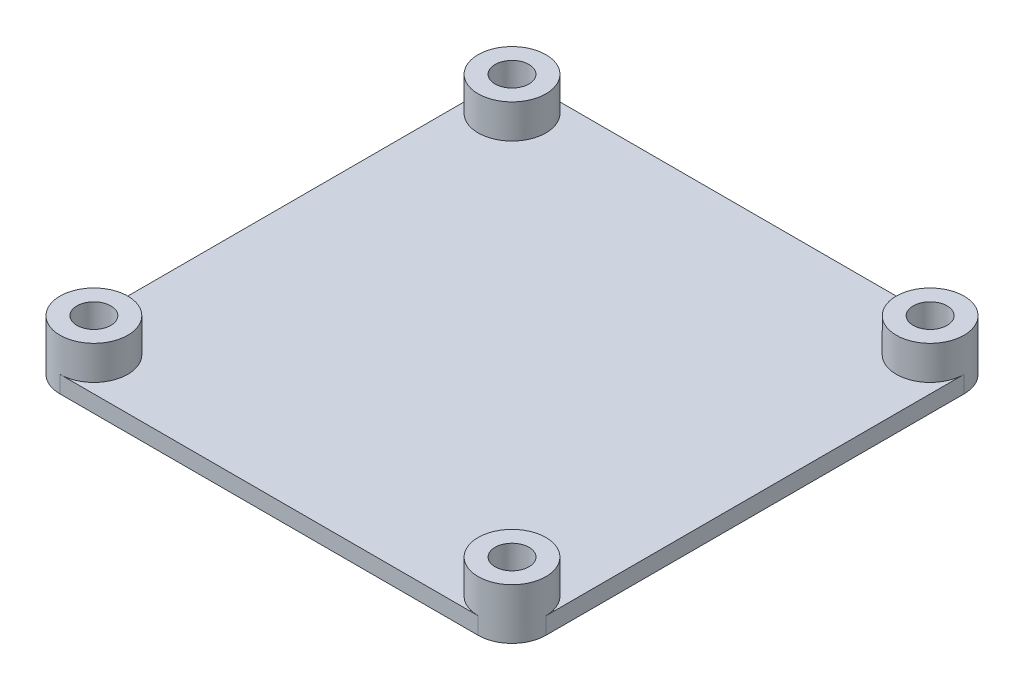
SolidWorks part; units mm, degrees
ref_plane "Plan de face" through (0, 0, 0) normal (0, 0, 1) x (1, 0, 0)
ref_plane "Plan de dessus" through (0, 0, 0) normal (0, 1, 0) x (1, 0, 0)
ref_plane "Plan de droite" through (0, 0, 0) normal (1, 0, 0) x (0, 0, -1)
sketch "Esquisse1" plane through (0, 0, 0) normal (0, 1, 0) x (1, 0, 0)
  line L1 (-18.5, 21.5) -> (18.5, 21.5)
  line L2 (-21.5, 18.5) -> (-21.5, -18.5)
  line L3 (-18.5, -21.5) -> (18.5, -21.5)
  line L4 (21.5, 18.5) -> (21.5, -18.5)
  arc A0 (-18.5, 21.5) -> (-21.5, 18.5) centre (-18.5, 18.5) ccw
  arc A1 (21.5, 18.5) -> (18.5, 21.5) centre (18.5, 18.5) ccw
  arc A2 (-21.5, -18.5) -> (-18.5, -21.5) centre (-18.5, -18.5) ccw
  arc A3 (18.5, -21.5) -> (21.5, -18.5) centre (18.5, -18.5) ccw
  dimension "D5" = 6
  dimension "D1" = 6
  dimension "D7" = 6
  dimension "D2" = 43
  dimension "D3" = 21.5
  dimension "D4" = 21.5
  dimension "D6" = 43
extrude "Boss.-Extru.2" add sketch "Esquisse1" along normal blind 1.5
sketch "Esquisse3" plane through (0, 1.5, 0) normal (0, 1, 0) x (1, 0, 0)
  circle A0 centre (-18.5, 18.5) radius 3
  arc A3 (-18.5, 21.5) -> (-21.5, 18.5) centre (-18.5, 18.5) ccw construction
  circle A4 centre (18.5, 18.5) radius 3
  circle A5 centre (18.5, -18.5) radius 3
  arc A6 (18.5, -21.5) -> (21.5, -18.5) centre (18.5, -18.5) ccw construction
  circle A7 centre (-18.5, -18.5) radius 3
  dimension "D1" = 6
extrude "Boss.-Extru.3" add sketch "Esquisse3" along normal blind 3
sketch "Esquisse4" plane through (0, 4.5, 0) normal (0, 1, 0) x (1, 0, 0)
  circle A0 centre (18.5, 18.5) radius 1.5
extrude "Enlèv. mat.-Extru.1" cut sketch "Esquisse4" against normal blind 5
sketch "Esquisse5" plane through (0, 4.5, 0) normal (0, 1, 0) x (1, 0, 0)
  circle A0 centre (18.5, -18.5) radius 1.5
  dimension "D1" = 3
extrude "Enlèv. mat.-Extru.2" cut sketch "Esquisse5" against normal blind 5
sketch "Esquisse6" plane through (0, 4.5, 0) normal (0, 1, 0) x (1, 0, 0)
  circle A0 centre (-18.5, 18.5) radius 1.5
  dimension "D1" = 3
extrude "Enlèv. mat.-Extru.3" cut sketch "Esquisse6" against normal blind 5
sketch "Esquisse7" plane through (0, 4.5, 0) normal (0, 1, 0) x (1, 0, 0)
  circle A0 centre (-18.5, -18.5) radius 1.5
  circle A1 centre (-18.5, -18.5) radius 3 construction
  dimension "D1" = 3
extrude "Enlèv. mat.-Extru.4" cut sketch "Esquisse7" against normal blind 5
